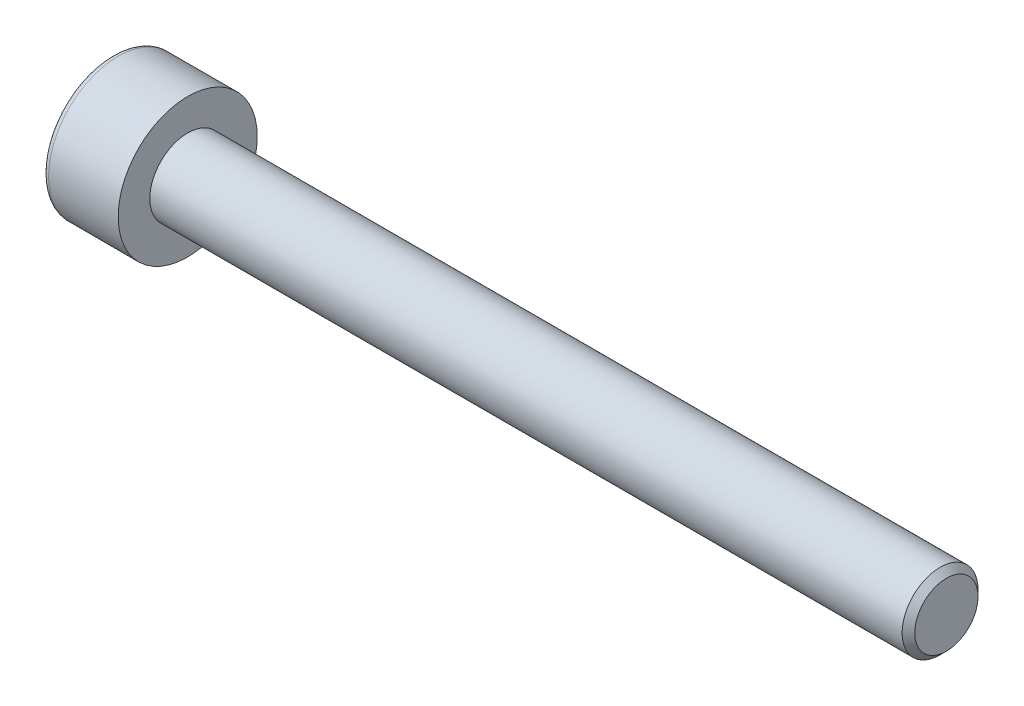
SolidWorks part; units mm, degrees
ref_plane "Plan1" through (0, 0, 0) normal (0, 0, 1) x (1, 0, 0)
ref_plane "Plan2" through (0, 0, 0) normal (0, 1, 0) x (1, 0, 0)
ref_plane "Plan3" through (0, 0, 0) normal (1, 0, 0) x (0, 0, -1)
sketch "Esquisse1" plane through (0, 0, 0) normal (0, 0, 1) x (1, 0, 0)
  line L0 (12.5013, 0) -> (-4.9882, 0) construction
  line L1 (0, 1.5) -> (0, 2.75)
  line L2 (0, 1.5) -> (30, 1.5)
  line L3 (30, 1.5) -> (30, 0)
  line L4 (0, 2.75) -> (-3, 2.75)
  line L5 (-3, 2.75) -> (-3, 0)
  line L6 (30, 0) -> (-3, 0)
  dimension "Ø tige" = 3
  dimension "Ø tete" = 5.5
  dimension "longueur tige" = 30
  dimension "hauteur tete" = 3
revolve "Base-Révolution" add sketch "Esquisse1" angle 360 about L0
chamfer "Chanfrein tige" distance 0.25 angle 45 1 edges at (30, 0, -1.5)
fillet "Congé tete" radius 0.25 1 edges at (-3, 0, -2.75)
sketch "Esquisse2" plane through (-3, 0, 0) normal (-1, 0, 0) x (0, 0, 1)
  line L1 (1.4434, 0) -> (0.7217, 1.25)
  line L2 (0.7217, 1.25) -> (-0.7217, 1.25)
  line L3 (-0.7217, 1.25) -> (-1.4434, 0)
  line L4 (-1.4434, 0) -> (-0.7217, -1.25)
  line L5 (-0.7217, -1.25) -> (0.7217, -1.25)
  line L6 (0.7217, -1.25) -> (1.4434, 0)
  circle A0 centre (0, 0) radius 1.25 construction
  dimension "largeur creux" = 2.5
extrude "Enlèv. mat.-Extru.1" cut sketch "Esquisse2" against normal blind 1.7
